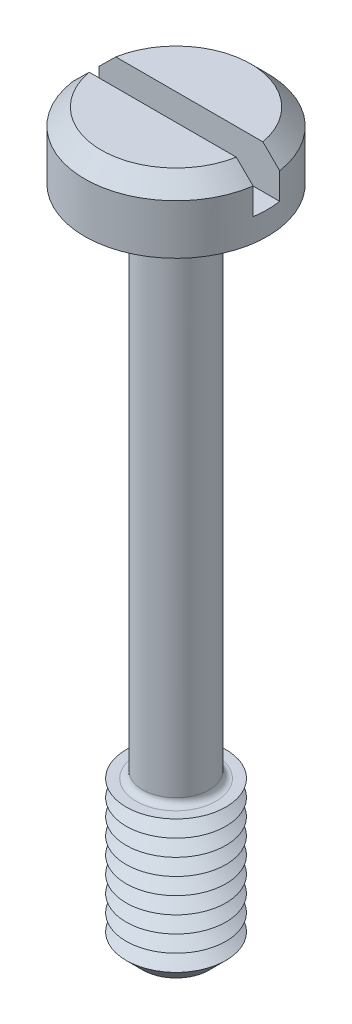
SolidWorks part; units mm, degrees
ref_plane "Front Plane" through (0, 0, 0) normal (0, 0, 1) x (1, 0, 0)
ref_plane "Top Plane" through (0, 0, 0) normal (0, 1, 0) x (1, 0, 0)
ref_plane "Right Plane" through (0, 0, 0) normal (1, 0, 0) x (0, 0, -1)
sketch "Sketch1" plane through (0, 0, 0) normal (0, 1, 0) x (1, 0, 0)
  circle A0 centre (0, 0) radius 2.75
  dimension "D1" = 5.5
extrude "Boss-Extrude1" add sketch "Sketch1" along normal blind 2
sketch "Sketch2" plane through (0, 0, 0) normal (0, -1, 0) x (1, 0, 0)
  circle A0 centre (0, 0) radius 1
  dimension "D1" = 2
extrude "Boss-Extrude2" add sketch "Sketch2" along normal blind 20
sketch "Sketch3" plane through (0, -20, 0) normal (0, -1, 0) x (1, 0, 0)
  circle A0 centre (0, 0) radius 1.5
  dimension "D1" = 3
extrude "Boss-Extrude3" add sketch "Sketch3" against normal blind 4.5
chamfer "Chamfer1" distance 0.5 angle 45 1 edges at (0, -20, -1.5)
sketch "Sketch4" plane through (0, 0, 0) normal (1, 0, 0) x (0, 0, -1)
  line L0 (0, -6.5871) -> (0, -12.0372) construction
sketch "Sketch5" plane through (0, 0, 0) normal (1, 0, 0) x (0, 0, -1)
  line L0 (-1.5, -15.5) -> (-1.067, -15.75)
  line L1 (-1.067, -15.75) -> (-1.5, -16)
  line L2 (-1.5, -15.5) -> (-1.5, -19.5) construction
  line L3 (-1.5, -16) -> (-1.5, -15.5)
  dimension "D1" = 0.5
revolve "Cut-Revolve1" cut sketch "Sketch5" angle 360 about L0
pattern_linear "LPattern1" count 8 spacing 0.5 along (0, -1, 0) of "Cut-Revolve1"
fillet "Fillet1" radius 0.2 2 edges at (0, -15.5, -1) (0, 0, -1)
chamfer "Chamfer2" distance 0.5 angle 45 1 edges at (0, 2, 2.75)
sketch "Sketch6" plane through (0, 2, 0) normal (0, 1, 0) x (1, 0, 0)
  line L1 (2.75, -0.4) -> (-2.75, -0.4)
  line L2 (2.75, -0.4) -> (2.75, 0.4)
  line L3 (2.75, 0.4) -> (-2.75, 0.4)
  line L4 (-2.75, -0.4) -> (-2.75, 0.4)
  line L5 (2.75, -0.4) -> (-2.75, 0.4) construction
  line L6 (2.75, 0.4) -> (-2.75, -0.4) construction
  circle A0 centre (0, 0) radius 2.75 construction
  point P0 (0, 0)
  dimension "D1" = 0.8
extrude "Cut-Extrude1" cut sketch "Sketch6" against normal blind 1.3
